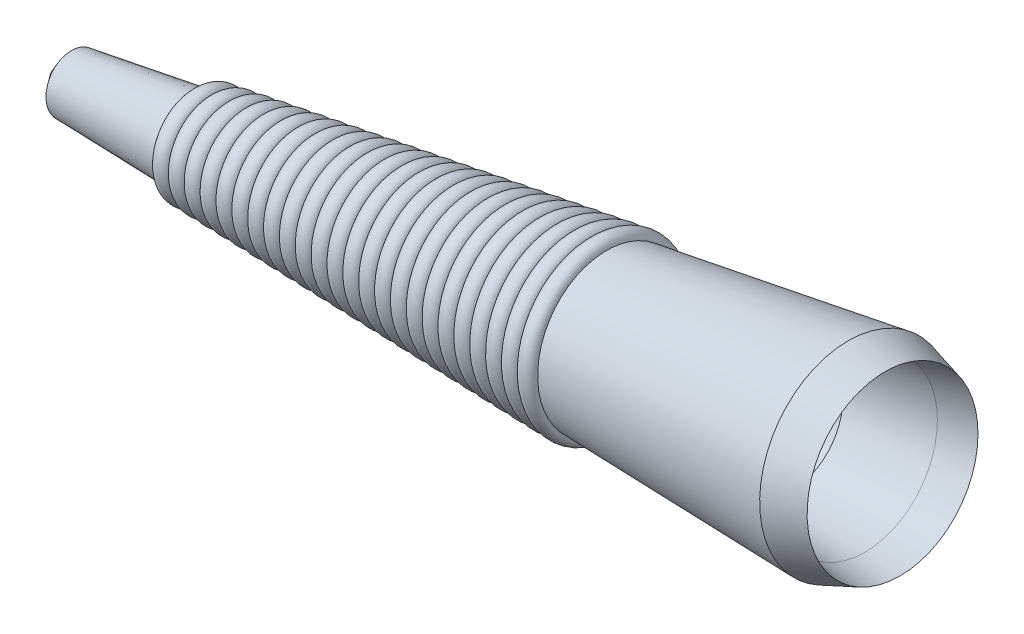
SolidWorks part; units mm, degrees
ref_plane "Front Plane" through (0, 0, 0) normal (0, 0, 1) x (1, 0, 0)
ref_plane "Top Plane" through (0, 0, 0) normal (0, 1, 0) x (1, 0, 0)
ref_plane "Right Plane" through (0, 0, 0) normal (1, 0, 0) x (0, 0, -1)
sketch "Sketch1" plane through (0, 0, 0) normal (0, 0, 1) x (1, 0, 0)
  line L0 (0, 0) -> (97.5367, 0) construction
  line L1 (0, 0) -> (6.35, -6.35)
  line L2 (6.35, -6.35) -> (50.8, -6.35)
  line L4 (292.1, 0) -> (259.4617, 0)
  line L5 (0, 0) -> (0, 25.5554) construction
  line L6 (203.2, -6.35) -> (292.1, -6.35)
  line L7 (145.1617, 12.7) -> (145.1617, 0) construction
  line L8 (0, 6.35) -> (292.1, 6.35) construction
  line L9 (145.1617, 0) -> (151.5117, 6.35)
  line L11 (151.5117, 6.35) -> (154.6867, 6.35)
  line L12 (148.3367, 0) -> (154.6867, 6.35)
  line L13 (-11.1934, -0.9793) -> (308.0638, 26.9521) construction
  line L14 (129.2867, 0) -> (135.6367, 6.35)
  line L16 (132.4617, 0) -> (138.8117, 6.35)
  line L17 (135.6367, 6.35) -> (138.8117, 6.35)
  line L18 (113.4117, 0) -> (119.7617, 6.35)
  line L20 (116.5867, 0) -> (122.9367, 6.35)
  line L21 (119.7617, 6.35) -> (122.9367, 6.35)
  line L22 (97.5367, 0) -> (103.8867, 6.35)
  line L24 (100.7117, 0) -> (107.0617, 6.35)
  line L25 (103.8867, 6.35) -> (107.0617, 6.35)
  line L26 (161.0367, 0) -> (167.3867, 6.35)
  line L28 (164.2117, 0) -> (170.5617, 6.35)
  line L29 (167.3867, 6.35) -> (170.5617, 6.35)
  line L30 (176.9117, 0) -> (183.2617, 6.35)
  line L32 (180.0867, 0) -> (186.4367, 6.35)
  line L33 (183.2617, 6.35) -> (186.4367, 6.35)
  line L34 (192.7867, 0) -> (199.1367, 6.35)
  line L36 (195.9617, 0) -> (202.3117, 6.35)
  line L37 (199.1367, 6.35) -> (202.3117, 6.35)
  line L38 (208.6617, 0) -> (215.0117, 6.35)
  line L40 (211.8367, 0) -> (218.1867, 6.35)
  line L41 (215.0117, 6.35) -> (218.1867, 6.35)
  line L42 (224.5367, 0) -> (230.8867, 6.35)
  line L44 (227.7117, 0) -> (234.0617, 6.35)
  line L45 (230.8867, 6.35) -> (234.0617, 6.35)
  line L46 (240.4117, 0) -> (246.7617, 6.35)
  line L48 (243.5867, 0) -> (249.9367, 6.35)
  line L49 (246.7617, 6.35) -> (249.9367, 6.35)
  line L50 (256.2867, 0) -> (262.6367, 6.35)
  line L52 (259.4617, 0) -> (265.8117, 6.35)
  line L53 (262.6367, 6.35) -> (265.8117, 6.35)
  line L54 (29.792, 5.7936) -> (85.7641, 10.6905) construction
  line L55 (100.7117, 0) -> (113.4117, 0) construction
  line L56 (97.5367, 0) -> (0, 0)
  line L58 (113.4117, 0) -> (100.7117, 0)
  line L59 (116.5867, 0) -> (129.2867, 0) construction
  line L60 (291.396, -1.1111) -> (312.3584, -1.1111) construction
  line L61 (129.2867, 0) -> (116.5867, 0)
  line L62 (132.4617, 0) -> (145.1617, 0) construction
  line L63 (145.1617, 0) -> (132.4617, 0)
  line L64 (148.3367, 0) -> (161.0367, 0) construction
  line L65 (164.2117, 0) -> (176.9117, 0) construction
  line L66 (161.0367, 0) -> (148.3367, 0)
  line L67 (176.9117, 0) -> (164.2117, 0)
  line L68 (180.0867, 0) -> (192.7867, 0) construction
  line L69 (192.7867, 0) -> (180.0867, 0)
  line L70 (195.9617, 0) -> (208.6617, 0) construction
  line L71 (208.6617, 0) -> (195.9617, 0)
  line L72 (211.8367, 0) -> (224.5367, 0) construction
  line L73 (224.5367, 0) -> (211.8367, 0)
  line L74 (227.7117, 0) -> (240.4117, 0) construction
  line L75 (240.4117, 0) -> (227.7117, 0)
  line L76 (243.5867, 0) -> (256.2867, 0) construction
  line L77 (256.2867, 0) -> (243.5867, 0)
  line L78 (259.4617, 0) -> (292.1, 0) construction
  line L79 (292.1, 0) -> (304.8, -1.1111)
  line L81 (292.1, 0) -> (292.1, 25.5554) construction
  line L82 (292.1, -6.35) -> (304.8, -1.1111)
  line L83 (292.1, 0) -> (292.1, -25.2445) construction
  arc A0 (57.15, -6.35) -> (50.8, -6.35) centre (53.975, -6.35) cw
  arc A1 (63.5, -6.35) -> (57.15, -6.35) centre (60.325, -6.35) cw
  arc A2 (69.85, -6.35) -> (63.5, -6.35) centre (66.675, -6.35) cw
  arc A3 (76.2, -6.35) -> (69.85, -6.35) centre (73.025, -6.35) cw
  arc A4 (82.55, -6.35) -> (76.2, -6.35) centre (79.375, -6.35) cw
  arc A5 (88.9, -6.35) -> (82.55, -6.35) centre (85.725, -6.35) cw
  arc A6 (95.25, -6.35) -> (88.9, -6.35) centre (92.075, -6.35) cw
  arc A7 (101.6, -6.35) -> (95.25, -6.35) centre (98.425, -6.35) cw
  arc A8 (107.95, -6.35) -> (101.6, -6.35) centre (104.775, -6.35) cw
  arc A9 (114.3, -6.35) -> (107.95, -6.35) centre (111.125, -6.35) cw
  arc A10 (120.65, -6.35) -> (114.3, -6.35) centre (117.475, -6.35) cw
  arc A11 (127, -6.35) -> (120.65, -6.35) centre (123.825, -6.35) cw
  arc A12 (133.35, -6.35) -> (127, -6.35) centre (130.175, -6.35) cw
  arc A13 (139.7, -6.35) -> (133.35, -6.35) centre (136.525, -6.35) cw
  arc A14 (146.05, -6.35) -> (139.7, -6.35) centre (142.875, -6.35) cw
  arc A15 (152.4, -6.35) -> (146.05, -6.35) centre (149.225, -6.35) cw
  arc A16 (158.75, -6.35) -> (152.4, -6.35) centre (155.575, -6.35) cw
  arc A17 (165.1, -6.35) -> (158.75, -6.35) centre (161.925, -6.35) cw
  arc A18 (171.45, -6.35) -> (165.1, -6.35) centre (168.275, -6.35) cw
  arc A19 (177.8, -6.35) -> (171.45, -6.35) centre (174.625, -6.35) cw
  arc A20 (184.15, -6.35) -> (177.8, -6.35) centre (180.975, -6.35) cw
  arc A21 (190.5, -6.35) -> (184.15, -6.35) centre (187.325, -6.35) cw
  arc A22 (196.85, -6.35) -> (190.5, -6.35) centre (193.675, -6.35) cw
  arc A23 (203.2, -6.35) -> (196.85, -6.35) centre (200.025, -6.35) cw
  point P4 (0, 0)
  point P29 (145.1617, 6.35)
  point P93 (313.1763, -1.1827)
  dimension "D12" = 3.175
  dimension "D1" = 292.1
  dimension "D2" = 45
  dimension "D3" = 6.35
  dimension "D4" = 4
  dimension "D5" = 3.175
  dimension "D6" = 3.175
  dimension "D7" = 5
  dimension "D8" = 12.7
  dimension "D10" = 12.7
  dimension "D11" = 50.8
  dimension "D14" = 6.35
  dimension "D15" = 45
  dimension "D16" = 175
  dimension "D17" = 12.7
  dimension "D9" = 8
  dimension "D13" = 24
revolve "Revolve2" add sketch "Sketch1" angle 360 about L54
